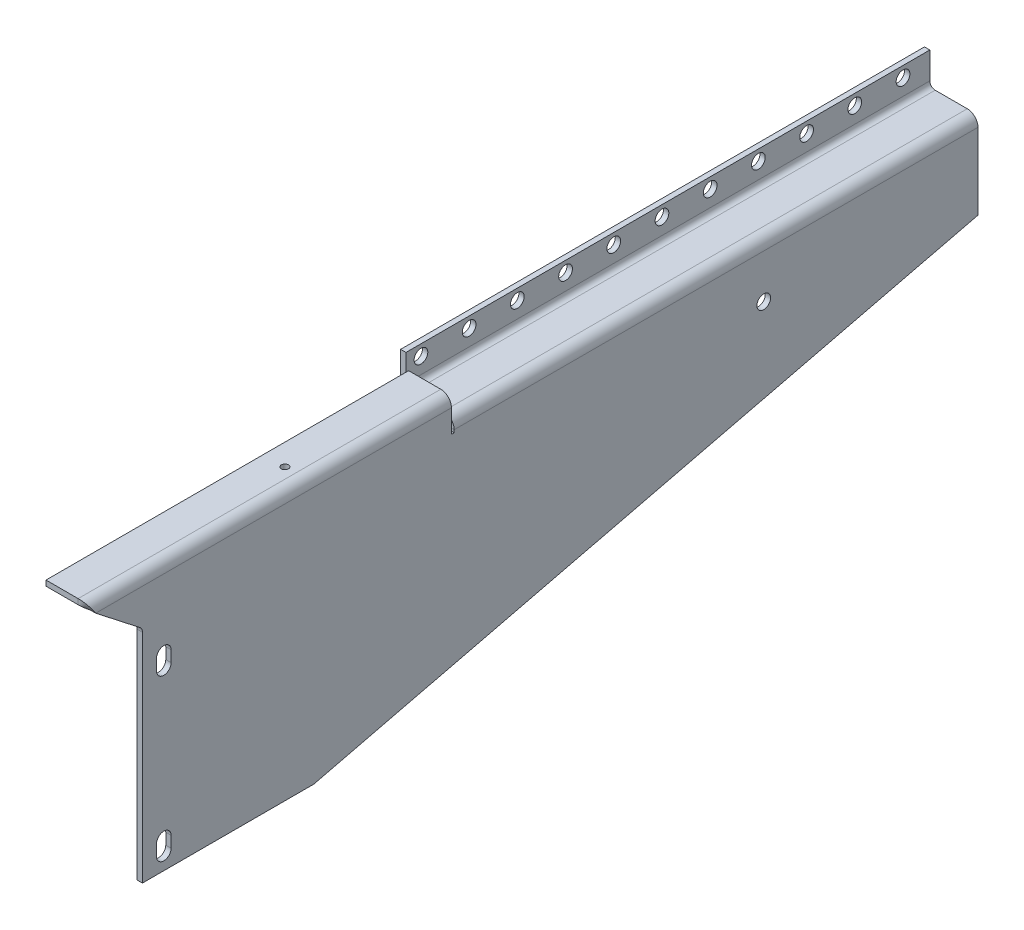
SolidWorks part; units mm, degrees
ref_plane "Plan de face" through (0, 0, 0) normal (0, 0, 1) x (1, 0, 0)
ref_plane "Plan de dessus" through (0, 0, 0) normal (0, 1, 0) x (1, 0, 0)
ref_plane "Plan de droite" through (0, 0, 0) normal (1, 0, 0) x (0, 0, -1)
mirrored part "TU030414_Rendre symétrique"
other "<TU030414>-<Enlèv. mat.-Extru.2>"
